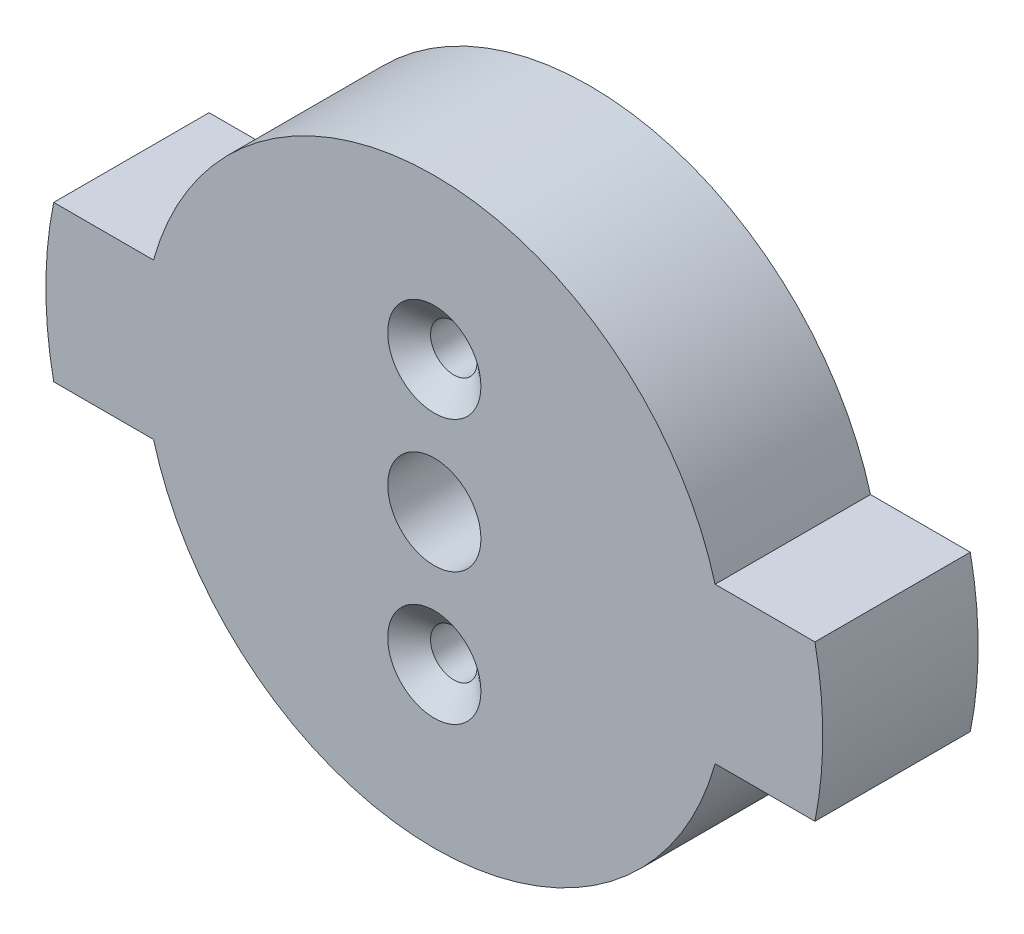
SolidWorks part; units mm, degrees
ref_plane "Front Plane" through (0, 0, 0) normal (0, 0, 1) x (1, 0, 0)
ref_plane "Top Plane" through (0, 0, 0) normal (0, 1, 0) x (1, 0, 0)
ref_plane "Right Plane" through (0, 0, 0) normal (1, 0, 0) x (0, 0, -1)
sketch "Sketch1" plane through (0, 0, 0) normal (0, 0, 1) x (1, 0, 0)
  circle A0 centre (0, 0) radius 9.525
  dimension "D1" = 19.05
extrude "Boss-Extrude1" add sketch "Sketch1" along normal blind 5.08
sketch "Sketch2" plane through (0, 0, 5.08) normal (0, 0, 1) x (1, 0, 0)
  line L0 (0, 4.318) -> (0, -4.318) construction
  circle A0 centre (0, 0) radius 1.524
  circle A1 centre (0, 4.318) radius 0.6985
  circle A2 centre (0, -4.318) radius 0.6985
  point P6 (0, 0)
  dimension "D1" = 3.048
  dimension "D3" = 1.397
  dimension "D4" = 1.397
  dimension "D2" = 8.636
extrude "Cut-Extrude1" cut sketch "Sketch2" against normal through all
hole_wizard "CSK for 1/4 Flat Head Machine Screw (100)1" positions "Sketch5" profile "Sketch6" countersink size "1/4" standard "ANSI Inch"
sketch "Sketch5" plane through (0, 0, 5.08) normal (0, 0, 1) x (1, 0, 0)
  point P0 (0, -4.318)
  point P3 (0, 4.318)
sketch "Sketch6" plane through (0, -4.318, 5.08) normal (1, 0, 0) x (0, -1, 0)
  line L0 (0, 0) -> (0, 5.08)
  line L1 (0, 5.08) -> (0.762, 5.08)
  line L2 (0.762, 5.08) -> (0.762, 0.6394)
  line L3 (0.762, 0.6394) -> (1.524, 0)
  line L5 (1.524, 0) -> (0, 0)
  line L6 (-0.762, 0.6394) -> (-1.524, 0) construction
  line L11 (0, -6.35) -> (0, 107.95) construction
  dimension "Thru Hole Dia." = 1.524
  dimension "Thru Hole Depth" = 5.08
  dimension "Near C'Sink Dia." = 3.048
  dimension "Near C'Sink Angle" = 100
sketch "Sketch7" plane through (0, 0, 0) normal (0, 0, -1) x (-1, 0, 0)
  circle A0 centre (0, 0) radius 2.54
  dimension "D1" = 5.08
extrude "Cut-Extrude2" cut sketch "Sketch7" against normal blind 1.27
sketch "Sketch8" plane through (0, 0, 5.08) normal (0, 0, 1) x (1, 0, 0)
  line L0 (-14.9046, 0) -> (14.9046, 0) construction
  line L1 (-9.1801, 2.54) -> (-12.4434, 2.54)
  line L2 (-12.4434, -2.54) -> (-9.1801, -2.54)
  line L3 (0, -8.1696) -> (0, 8.3221) construction
  line L4 (9.1801, 2.54) -> (12.4434, 2.54)
  line L5 (12.4434, -2.54) -> (9.1801, -2.54)
  arc A0 (-9.1801, 2.54) -> (-9.1801, -2.54) centre (0, 0) ccw
  arc A1 (-12.4434, 2.54) -> (-12.4434, -2.54) centre (0, 0) ccw
  arc A2 (12.4434, 2.54) -> (12.4434, -2.54) centre (0, 0) cw
  arc A3 (9.1801, 2.54) -> (9.1801, -2.54) centre (0, 0) cw
  point P7 (0, 0)
  dimension "D1" = 2.54
  dimension "D3" = 12.7
  dimension "D2" = 2.54
extrude "Boss-Extrude2" add sketch "Sketch8" against normal up to surface (5.08 mm away) contours L4 A2 L5 A3 | A0 L2 A1 L1
